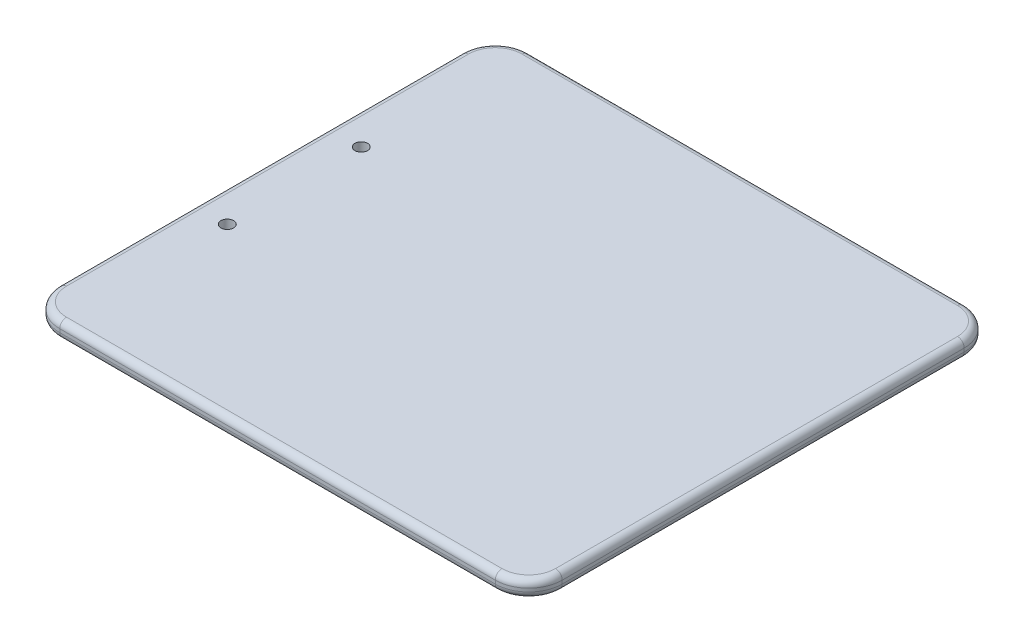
SolidWorks part; units mm, degrees
ref_plane "Front Plane" through (0, 0, 0) normal (0, 0, 1) x (1, 0, 0)
ref_plane "Top Plane" through (0, 0, 0) normal (0, 1, 0) x (1, 0, 0)
ref_plane "Right Plane" through (0, 0, 0) normal (1, 0, 0) x (0, 0, -1)
sketch "Sketch1" plane through (0, 0, 0) normal (0, 1, 0) x (1, 0, 0)
  line L1 (-75, -70) -> (75, -70)
  line L2 (-75, -70) -> (-75, 70)
  line L3 (-75, 70) -> (75, 70)
  line L4 (75, -70) -> (75, 70)
  line L5 (-75, -70) -> (75, 70) construction
  line L6 (-75, 70) -> (75, -70) construction
  point P0 (0, 0)
  dimension "D1" = 150
  dimension "D2" = 140
extrude "Boss-Extrude1" add sketch "Sketch1" against normal blind 5
fillet "Fillet1" radius 2 8 edges at (0, 0, -70) (-75, 0, 0) (0, 0, 70) (75, 0, 0) (0, -5, 70) (-75, -5, 0) (0, -5, -70) (75, -5, 0)
hole_wizard "#6 Clearance Hole2" positions "Sketch4" profile "Sketch3" hole size "#6" standard "Ansi Inch"
sketch "Sketch4" plane through (0, -5, 0) normal (0, -1, 0) x (1, 0, 0)
  point P0 (-65, -20)
  point P1 (-65, 20)
sketch "Sketch3" plane through (-65, -5, -20) normal (1, 0, 0) x (0, 0, -1)
  line L0 (0, 0) -> (0, 6.1408)
  line L1 (0, 6.1408) -> (1.8986, 5)
  line L2 (1.8986, 5) -> (1.8986, 0)
  line L5 (1.8986, 0) -> (0, 0)
  line L10 (0, 6.1408) -> (-1.8987, 5) construction
  line L11 (0, -6.35) -> (0, 107.95) construction
  dimension "Hole Dia." = 3.7973
  dimension "Hole Depth" = 5
  dimension "Drill Angle" = 118
sketch "Sketch6"
fillet "Fillet2" radius 10 3 edges at (-74.4142, -0.5858, -69.4142) (-74.4142, -4.4142, -69.4142) (-75, -2.5, -70)
fillet "Fillet3" radius 10 9 edges at (74.4142, -0.5858, -69.4142) (74.4142, -4.4142, 69.4142) (-74.4142, -0.5858, 69.4142) (74.4142, -4.4142, -69.4142) (74.4142, -0.5858, 69.4142) (-74.4142, -4.4142, 69.4142) (-75, -2.5, 70) (75, -2.5, 70) (75, -2.5, -70)
